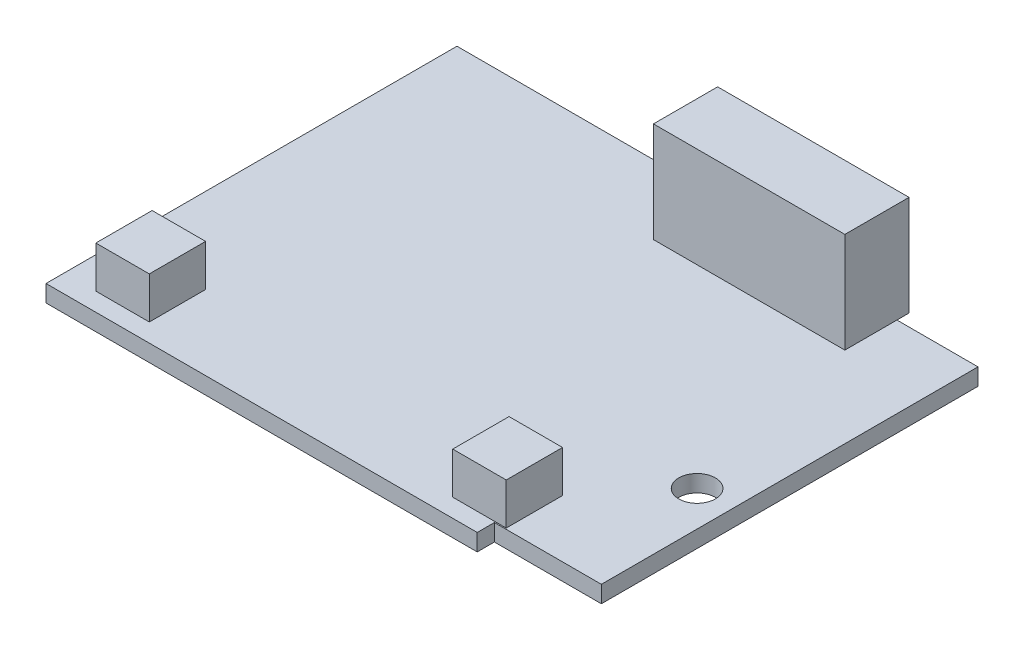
SolidWorks part; units mm, degrees
ref_plane "Front" through (0, 0, 0) normal (0, 0, 1) x (1, 0, 0)
ref_plane "Top" through (0, 0, 0) normal (0, 1, 0) x (1, 0, 0)
ref_plane "Right" through (0, 0, 0) normal (1, 0, 0) x (0, 0, -1)
sketch "Sketch1" plane through (0, 0, 0) normal (0, 1, 0) x (1, 0, 0)
  line L0 (-9.652, 18.542) -> (-9.652, 16.9926)
  line L1 (-48.5648, 18.542) -> (-9.652, 18.542)
  line L2 (-48.5648, 18.542) -> (-48.5648, -18.542)
  line L3 (-48.5648, -18.542) -> (-9.652, -18.542)
  line L4 (0, 16.9926) -> (0, -16.9926)
  line L5 (-9.652, 16.9926) -> (0, 16.9926)
  line L6 (-9.652, -18.542) -> (-9.652, -16.9926)
  line L7 (-9.652, -16.9926) -> (0, -16.9926)
  line L8 (0, 0) -> (-48.5648, 0) construction
  circle A0 centre (-3.175, -5.1816) radius 1.651
  dimension "D6" = 3.302
  dimension "D7" = 1.524
  dimension "D1" = 37.084
  dimension "D2" = 48.5648
  dimension "D3" = 9.652
  dimension "D4" = 33.9852
  dimension "D5" = 10.16
extrude "Extrude1" add sketch "Sketch1" along normal blind 1.524
sketch "Sketch2" plane through (0, 1.524, 0) normal (0, 1, 0) x (1, 0, 0)
  line L0 (0, -16.9926) -> (0, 16.9926) construction
  line L1 (-24.5872, 18.0848) -> (-7.3152, 18.0848)
  line L2 (-24.5872, 18.0848) -> (-24.5872, 12.2936)
  line L3 (-24.5872, 12.2936) -> (-7.3152, 12.2936)
  line L4 (-7.3152, 18.0848) -> (-7.3152, 12.2936)
  line L5 (-9.652, 18.542) -> (-48.5648, 18.542) construction
  dimension "D1" = 17.272
  dimension "D2" = 5.7912
  dimension "D3" = 7.3152
  dimension "D4" = 0.4572
extrude "Header+Conn" add sketch "Sketch2" along normal blind 9.0424
sketch "Sketch3" plane through (0, 1.524, 0) normal (0, 1, 0) x (1, 0, 0)
  line L0 (-48.5648, -18.542) -> (-9.652, -18.542) construction
  line L1 (-45.72, -11.811) -> (-40.894, -11.811)
  line L2 (-45.72, -11.811) -> (-45.72, -16.891)
  line L3 (-45.72, -16.891) -> (-40.894, -16.891)
  line L4 (-40.894, -11.811) -> (-40.894, -16.891)
  line L5 (-13.5128, -11.811) -> (-8.6868, -11.811)
  line L6 (-13.5128, -11.811) -> (-13.5128, -16.891)
  line L7 (-13.5128, -16.891) -> (-8.6868, -16.891)
  line L8 (-8.6868, -11.811) -> (-8.6868, -16.891)
  line L9 (-48.5648, 18.542) -> (-48.5648, -18.542) construction
  line L10 (0, -16.9926) -> (0, 16.9926) construction
  dimension "D1" = 4.826
  dimension "D2" = 4.826
  dimension "D3" = 5.08
  dimension "D4" = 5.08
  dimension "D5" = 1.651
  dimension "D6" = 2.8448
  dimension "D7" = 8.6868
extrude "TrimPots" add sketch "Sketch3" along normal offset from surface (3.7592 mm away) 5.2832
sketch "Sketch5" plane through (0, 0, 0) normal (0, 0, 1) x (1, 0, 0)
  line L0 (0, 0) -> (0.3249, -15.5117)
  line L1 (0, 0) -> (0, -24.1193) construction
  dimension "D1" = 1.2
sketch "Sketch4" plane through (0, 0, 0) normal (0, -1, 0) x (1, 0, 0)
  line L0 (-30.4038, -3.8862) -> (-47.1678, -3.8862)
  line L1 (-47.1678, 6.096) -> (-30.4038, 6.096)
  line L2 (-47.1678, 6.096) -> (-47.1678, 3.683)
  line L3 (-47.1678, -6.2992) -> (-30.4038, -6.2992)
  line L4 (-30.4038, 6.096) -> (-30.4038, 3.683)
  line L5 (-30.4038, 3.683) -> (-47.1678, 3.683)
  line L6 (-47.1678, -3.8862) -> (-47.1678, -6.2992)
  line L7 (-30.4038, -3.8862) -> (-30.4038, -6.2992)
  line L8 (-48.5648, -18.542) -> (-48.5648, 18.542) construction
  line L9 (-9.652, -18.542) -> (-48.5648, -18.542) construction
  dimension "D1" = 12.3952
  dimension "D2" = 2.413
  dimension "D3" = 2.413
  dimension "D4" = 16.764
  dimension "D5" = 1.397
  dimension "D6" = 12.2428
extrude "Extrude4" add sketch "Sketch4" along direction (0.0209, -0.9998, 0) on the side of the normal blind 6.477
